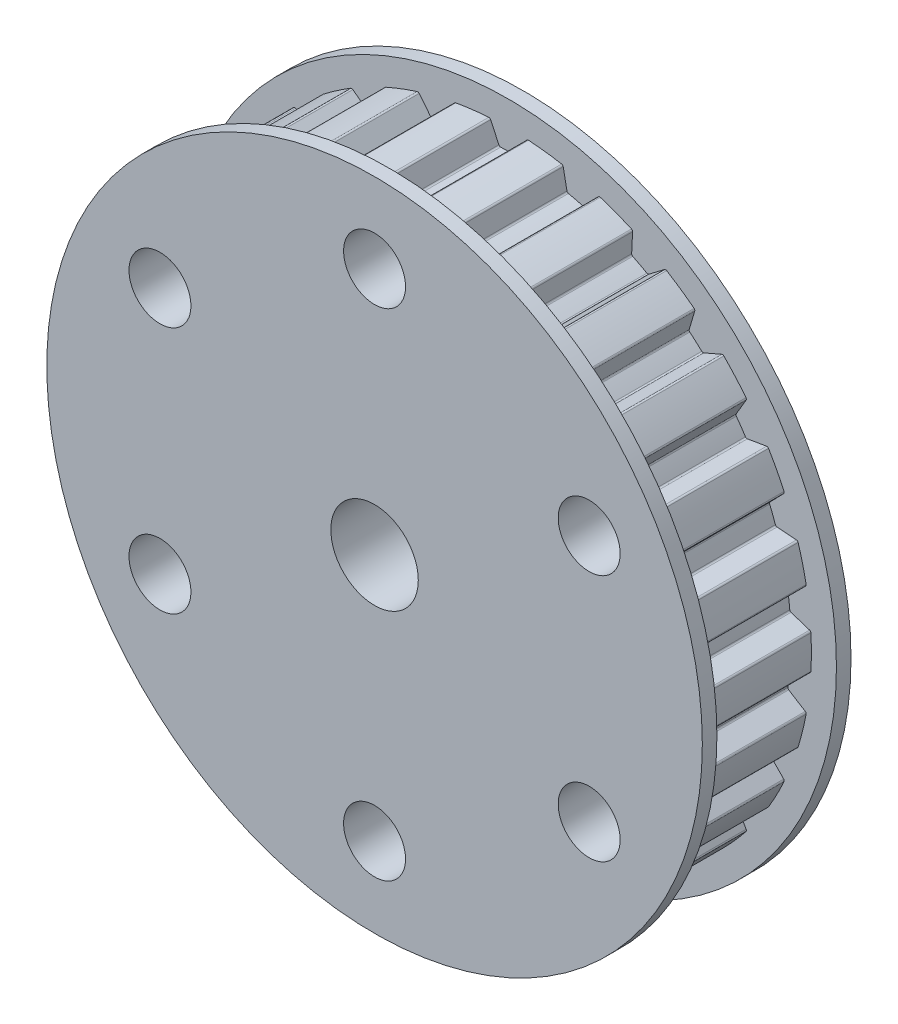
SolidWorks part; units mm, degrees
ref_plane "Front Plane" through (0, 0, 0) normal (0, 0, 1) x (1, 0, 0)
ref_plane "Top Plane" through (0, 0, 0) normal (0, 1, 0) x (1, 0, 0)
ref_plane "Right Plane" through (0, 0, 0) normal (1, 0, 0) x (0, 0, -1)
other "Tabla de configuración"
sketch "Sketch1" plane through (0, 0, 0) normal (0, 0, 1) x (1, 0, 0)
  circle A0 centre (0, 0) radius 20.765
  dimension "D1" = 41.53
extrude "Boss-Extrude1" add sketch "Sketch1" along normal blind 8.2
sketch "Sketch2" plane through (0, 0, 8.2) normal (0, 0, 1) x (1, 0, 0)
  line L0 (0, 20.765) -> (0, 5.2475) construction
  line L1 (-1.2744, 20.7259) -> (-0.6712, 19.4322)
  line L2 (1.2744, 20.7259) -> (0.6712, 19.4322)
  arc A0 (0.5497, 19.3572) -> (-0.5497, 19.3572) centre (0, 0) ccw
  circle A1 centre (0, 0) radius 20.765 construction
  arc A2 (1.2744, 20.7259) -> (-1.2744, 20.7259) centre (0, 0) ccw
  arc A3 (0.6712, 19.4322) -> (0.5497, 19.3572) centre (0.5534, 19.4871) cw
  arc A4 (-0.5497, 19.3572) -> (-0.6712, 19.4322) centre (-0.5534, 19.4871) cw
  point P13 (0.635, 19.3546)
  point P16 (-0.635, 19.3546)
  dimension "D1" = 1.4
  dimension "D4" = 0.13
  dimension "D2" = 50
  dimension "D3" = 1.27
extrude "Cut-Extrude1" cut sketch "Sketch2" against normal up to next
fillet "Fillet1" radius 0.13 2 edges at (1.2744, 20.7259, 4.1) (-1.2744, 20.7259, 4.1)
pattern_circular "CirPattern1" count 26 over 360 about axis through (0, 0, 0) along (0, 0, 1) of "Fillet1", "Cut-Extrude1"
ref_plane "Plano1" through (0, 0, 4.1) normal (0, 0, 1) x (1, 0, 0)
sketch "Croquis1" plane through (0, 0, 8.2) normal (0, 0, 1) x (1, 0, 0)
  circle A0 centre (0, 0) radius 22.485
  dimension "D1" = 44.97
extrude "Saliente-Extruir1" add sketch "Croquis1" along normal blind 1
mirror "Simetría1" about plane through (0, 0, 4.1) normal (0, 0, 1) of "Saliente-Extruir1"
sketch "Croquis4" [suppressed] plane through (0, 0, 9.2) normal (0, 0, 1) x (1, 0, 0)
  circle A1 centre (0, 0) radius 22.485
  circle A2 centre (0, 0) radius 22.485
  dimension "D1" = 0
extrude "Saliente-Extruir2" [suppressed] add sketch "Croquis4" along normal blind 4.8 draft 10
sketch "Croquis2" plane through (0, 0, 0) normal (0, 0, 1) x (1, 0, 0)
  circle A0 centre (0, 0) radius 3
  dimension "D1" = 6
extrude "Cortar-Extruir1" cut sketch "Croquis2" against normal through all and the other way through all
sketch "Croquis3" plane through (0, 0, 0) normal (0, 0, 1) x (1, 0, 0)
  circle A0 centre (0, 0) radius 17 construction
  circle A1 centre (0, 17) radius 2.125
  circle A2 centre (14.7224, 8.5) radius 2.125
  circle A3 centre (14.7224, -8.5) radius 2.125
  circle A4 centre (0, -17) radius 2.125
  circle A5 centre (-14.7224, -8.5) radius 2.125
  circle A6 centre (-14.7224, 8.5) radius 2.125
  point P17 (0, 0)
  dimension "D1" = 4.25
  dimension "D2" = 34
  dimension "D3" = 6
extrude "Cortar-Extruir2" cut sketch "Croquis3" against normal through all and the other way through all
